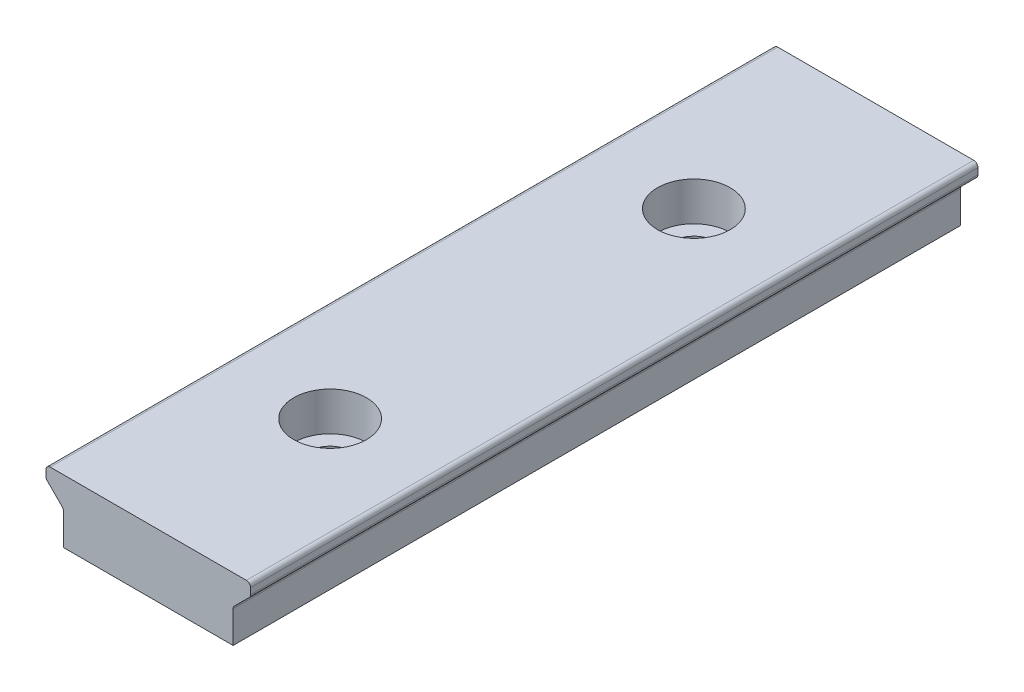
SolidWorks part; units mm, degrees
ref_plane "Front" through (0, 0, 0) normal (0, 0, 1) x (1, 0, 0)
ref_plane "bottom" through (0, 0, 0) normal (0, 1, 0) x (1, 0, 0)
ref_plane "center" through (0, 0, 0) normal (1, 0, 0) x (0, 0, -1)
sketch "Sketch2" plane through (0, 0, 0) normal (0, 0, 1) x (1, 0, 0)
  line L0 (7, 5.2) -> (8.4342, 5.2)
  line L1 (0, 5.2) -> (7, 5.2)
  line L2 (0, 5.2) -> (0, 0)
  line L3 (0, 0) -> (7, 0)
  line L4 (7, 2.7658) -> (7, 0)
  line L5 (8.4342, 5.2) -> (8.4342, 4.2)
  line L6 (8.4342, 4.2) -> (7, 2.7658)
  dimension "D1" = 5.2
  dimension "D2" = 7
  dimension "D3" = 45
  dimension "D4" = 1
extrude "Extrude3" add sketch "Sketch2" along normal blind 60
fillet "Fillet1" radius 0.35
mirror "Mirror1" about plane through (0, 0, 0) normal (1, 0, 0)
hole_wizard "CBORE for M3 SBHCS1" positions "Sketch4" profile "Sketch3" counterbore size "M3" standard "Ansi Metric"
sketch "Sketch4" plane through (0, 5.2, 0) normal (0, 1, 0) x (-1, 0, 0)
  line L0 (-8.0842, 0) -> (8.0842, 0) construction
  point P0 (0, 15)
  dimension "D1" = 15
sketch "Sketch3" plane through (0, 5.2, 15) normal (1, 0, 0) x (0, 0, 1)
  line L0 (0, 0) -> (0, 26.4515)
  line L1 (0, 26.4515) -> (1.75, 25.4)
  line L2 (1.75, 25.4) -> (1.75, 3.2)
  line L3 (1.75, 3.2) -> (3, 3.2)
  line L4 (3, 3.2) -> (3, 0)
  line L5 (3, 0) -> (0, 0)
  line L10 (0, 26.4515) -> (-1.75, 25.4) construction
  line L11 (0, -6.35) -> (0, 107.95) construction
  dimension "Hole Dia." = 3.5
  dimension "Hole Depth" = 25.4
  dimension "C'Bore Dia." = 6
  dimension "C'Bore Depth" = 3.2
  dimension "Drill Angle" = 118
pattern_linear "LPattern1" count 2 spacing 30
